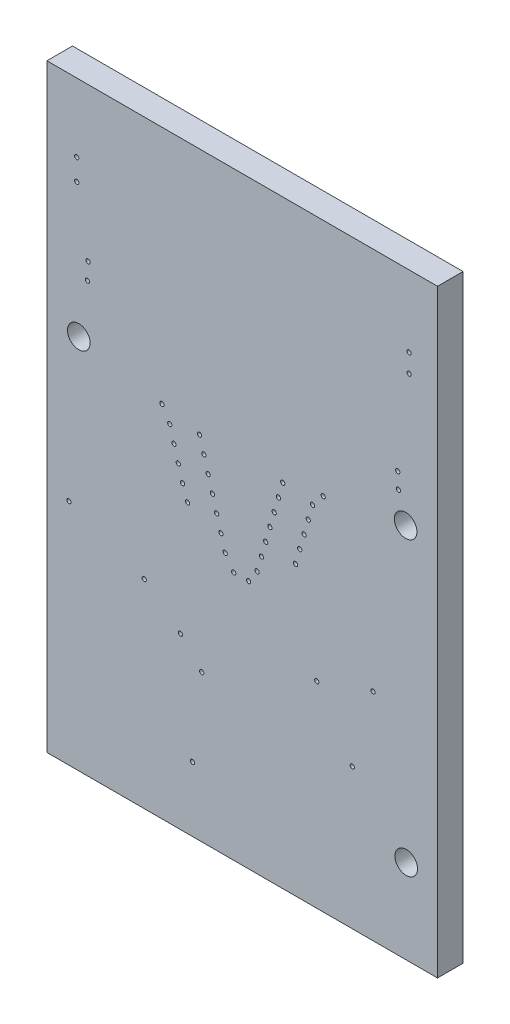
SolidWorks part; units mm, degrees
ref_plane "Front Plane" through (0, 0, 0) normal (0, 0, 1) x (1, 0, 0)
ref_plane "Top Plane" through (0, 0, 0) normal (0, 1, 0) x (1, 0, 0)
ref_plane "Right Plane" through (0, 0, 0) normal (1, 0, 0) x (0, 0, -1)
ref_plane "Dielectric_Layer Layer 1" through (0, 0, 0.9144) normal (0, 0, 1) x (1, 0, 0)
sketch "Sketch1" plane through (0, 0, 0) normal (0, 0, 1) x (1, 0, 0)
  line L0 (0, 0) -> (0, 21.4249)
  line L1 (0, 21.4249) -> (13.97, 21.4249)
  line L2 (13.97, 21.4249) -> (13.97, 0)
  line L3 (13.97, 0) -> (0, 0)
extrude "Board_Outline" add sketch "Sketch1" along normal blind 0.9144 separate body
sketch "Sketch2" plane through (0, 0, 0) normal (0, 0, 1) x (1, 0, 0)
  circle A0 centre (11.6634, 7.7216) radius 0.0762
  circle A1 centre (12.954, 18.2118) radius 0.0762
  circle A2 centre (1.0668, 18.9738) radius 0.0762
  circle A3 centre (10.922, 5.0292) radius 0.0762
  circle A4 centre (0.7874, 8.1788) radius 0.0762
  circle A5 centre (5.207, 2.3114) radius 0.0762
  circle A6 centre (1.4732, 15.9512) radius 0.0762
  circle A7 centre (1.4478, 15.3416) radius 0.0762
  circle A8 centre (4.1148, 12.8524) radius 0.0762
  circle A9 centre (4.3942, 12.3698) radius 0.0762
  circle A10 centre (4.5466, 11.8364) radius 0.0762
  circle A11 centre (4.699, 11.303) radius 0.0762
  circle A12 centre (4.8514, 10.7696) radius 0.0762
  circle A13 centre (5.0292, 10.2616) radius 0.0762
  circle A14 centre (5.461, 12.573) radius 0.0762
  circle A15 centre (5.6134, 12.0396) radius 0.0762
  circle A16 centre (5.7658, 11.5062) radius 0.0762
  circle A17 centre (5.9182, 10.9728) radius 0.0762
  circle A18 centre (6.0706, 10.4394) radius 0.0762
  circle A19 centre (6.223, 9.906) radius 0.0762
  circle A20 centre (6.3754, 9.3726) radius 0.0762
  circle A21 centre (6.6802, 8.9154) radius 0.0762
  circle A22 centre (12.5476, 14.986) radius 0.0762
  circle A23 centre (12.573, 14.4272) radius 0.0762
  circle A24 centre (9.8806, 12.8778) radius 0.0762
  circle A25 centre (9.4996, 12.4206) radius 0.0762
  circle A26 centre (9.3472, 11.8872) radius 0.0762
  circle A27 centre (9.1948, 11.3538) radius 0.0762
  circle A28 centre (9.0424, 10.8204) radius 0.0762
  circle A29 centre (8.89, 10.287) radius 0.0762
  circle A30 centre (8.4328, 12.573) radius 0.0762
  circle A31 centre (8.2804, 12.0396) radius 0.0762
  circle A32 centre (8.128, 11.5062) radius 0.0762
  circle A33 centre (7.9756, 10.9728) radius 0.0762
  circle A34 centre (7.8232, 10.4394) radius 0.0762
  circle A35 centre (7.6708, 9.906) radius 0.0762
  circle A36 centre (7.5184, 9.3726) radius 0.0762
  circle A37 centre (7.2136, 8.9154) radius 0.0762
  circle A38 centre (12.954, 18.8722) radius 0.0762
  circle A39 centre (1.0668, 18.2118) radius 0.0762
  circle A40 centre (9.652, 7.0358) radius 0.0762
  circle A41 centre (3.4798, 7.112) radius 0.0762
  circle A42 centre (5.5372, 5.2578) radius 0.0762
  circle A43 centre (4.7752, 6.0706) radius 0.0762
extrude "NPTH" cut sketch "Sketch2" along normal through all
sketch "Sketch3" plane through (0, 0, 0) normal (0, 0, 1) x (1, 0, 0)
  circle A0 centre (12.83, 13.45) radius 0.405
  circle A1 centre (1.14, 13.45) radius 0.405
  circle A2 centre (12.85, 3.02) radius 0.405
extrude "PTH" cut sketch "Sketch3" along normal through all
